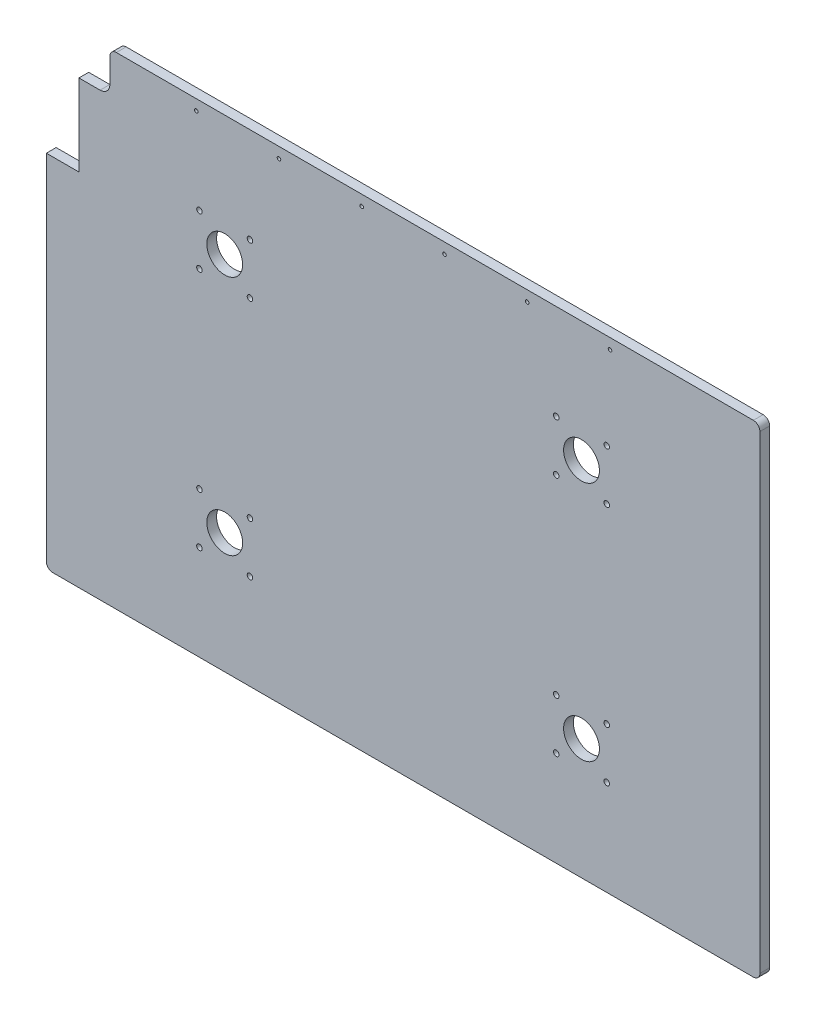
SolidWorks part; units mm, degrees
ref_plane "Front" through (0, 0, 0) normal (0, 0, 1) x (1, 0, 0)
ref_plane "Top" through (0, 0, 0) normal (0, 1, 0) x (1, 0, 0)
ref_plane "Right" through (0, 0, 0) normal (1, 0, 0) x (0, 0, -1)
ref_plane "deck plane" through (0, 0, 66) normal (0, 0, 1) x (1, 0, 0)
sketch "Sketch2" plane through (0, 0, 66) normal (0, 0, 1) x (1, 0, 0)
  line L0 (-221, 155.5) -> (-221, -155.5) construction
  line L1 (-219, 143.5) -> (219, 143.5)
  line L2 (-219, 143.5) -> (-219, -152.5)
  line L3 (-219, -152.5) -> (219, -152.5)
  line L4 (219, 143.5) -> (219, -152.5)
  line L5 (221, -155.5) -> (221, 155.5) construction
  line L6 (-221, -155.5) -> (221, -155.5) construction
  line L7 (221, 155.5) -> (-221, 155.5) construction
  dimension "D1" = 2
  dimension "D2" = 2
  dimension "D3" = 3
  dimension "D4" = 12
extrude "Boss-Extrude1" add sketch "Sketch2" along normal blind 6
sketch "motor locations" plane through (0, 0, 72) normal (0, 0, 1) x (1, 0, 0)
  line L0 (219, -4.5) -> (-219, -4.5) construction
  line L1 (219, -152.5) -> (219, 143.5) construction
  line L2 (-219, 143.5) -> (-219, -152.5) construction
  line L3 (0, 143.5) -> (0, -152.5) construction
  line L4 (219, 143.5) -> (-219, 143.5) construction
  line L5 (-219, -152.5) -> (219, -152.5) construction
  line L6 (-219, -152.5) -> (0, -4.5) construction
  line L7 (-219, 143.5) -> (0, -4.5) construction
  line L8 (0, -4.5) -> (219, 143.5) construction
  line L9 (219, -152.5) -> (0, -4.5) construction
  point P20 (-109.5, -78.5)
  point P22 (109.5, -78.5)
  point P23 (109.5, 69.5)
  point P24 (-109.5, 69.5)
  point P26 (0, 0)
  point P27 (0, 0)
  point P28 (0, 0)
  point P29 (0, 0)
  dimension "D1" = 109.5
  dimension "D2" = 74
  dimension "D3" = 74
  dimension "D4" = 4.5
  dimension "D5" = 296
  dimension "D6" = 438
sketch "Sketch3" plane through (0, 0, 72) normal (0, 0, 1) x (1, 0, 0)
  line L1 (-219, -152.5) -> (219, -152.5) construction
  line B0 (-130.65, -99.65) -> (-88.35, -99.65) construction
  circle B1 centre (-109.5, -78.5) radius 11
  circle B2 centre (-125, -94) radius 1.7
  circle B3 centre (-94, -94) radius 1.7
  circle B4 centre (-125, -63) radius 1.7
  circle B5 centre (-94, -63) radius 1.7
sketch_block_instance "Block-NEMA17-mounting-1"
sketch_block "Block-NEMA17-mounting" parameters "D1"=22, "D2"=3.4, "D3"=31, "D4"=42.3
extrude "first motor mount" cut sketch "Sketch3" against normal through all
pattern_sketch "motor pattern" of "first motor mount"
sketch "Sketch4" plane through (0, 0, 66) normal (0, 0, -1) x (-1, 0, 0)
  circle A0 centre (127, 136.9747) radius 1.1
  circle A1 centre (76.2, 136.9747) radius 1.1
  circle A2 centre (25.4, 136.9747) radius 1.1
  circle A3 centre (-25.4, 136.9747) radius 1.1
  circle A4 centre (-76.2, 136.9747) radius 1.1
  circle A5 centre (-127, 136.9747) radius 1.1
  circle A6 centre (-127, 136.9747) radius 2.3564 construction
  circle A7 centre (-76.2, 136.9747) radius 2.3564 construction
  circle A8 centre (-25.4, 136.9747) radius 2.3564 construction
  circle A9 centre (25.4, 136.9747) radius 2.3564 construction
  circle A10 centre (76.2, 136.9747) radius 2.3564 construction
  circle A11 centre (127, 136.9747) radius 2.3564 construction
  circle A12 centre (-127, 136.9747) radius 2.3564 construction
  circle A13 centre (-76.2, 136.9747) radius 2.3564 construction
  circle A14 centre (-25.4, 136.9747) radius 2.3564 construction
  circle A15 centre (25.4, 136.9747) radius 2.3564 construction
  circle A16 centre (76.2, 136.9747) radius 2.3564 construction
  circle A17 centre (127, 136.9747) radius 2.3564 construction
  dimension "D1" = 2.2
extrude "hinge screw pilot holes" cut sketch "Sketch4" against normal through all
sketch "Sketch5" plane through (0, 0, 72) normal (0, 0, 1) x (1, 0, 0)
  line L0 (-180, 143.5) -> (-205, 143.5)
  line L1 (219, 143.5) -> (-219, 143.5) construction
  line L2 (-205, 143.5) -> (-205, 124.5)
  line L3 (-199, 118.5) -> (-186, 118.5)
  line L4 (-180, 124.5) -> (-180, 143.5)
  line L6 (-219, 143.5) -> (-219, -152.5) construction
  arc A0 (-205, 124.5) -> (-199, 118.5) centre (-199, 124.5) ccw
  arc A1 (-186, 118.5) -> (-180, 124.5) centre (-186, 124.5) ccw
  dimension "D1" = 6
  dimension "D2" = 25
  dimension "D3" = 25
  dimension "D4" = 14
extrude "cable and wire notch" cut sketch "Sketch5" against normal up to next
fillet "Fillet1" radius 4 6 edges at (219, 143.5, 69) (219, -152.5, 69) (-219, -152.5, 69) (-219, 143.5, 69) (-180, 143.5, 69) (-205, 143.5, 69)
sketch "Sketch6" plane through (0, 0, 72) normal (0, 0, 1) x (1, 0, 0)
  line L0 (-219, 139.5) -> (-219, -148.5) construction
  line L1 (-219, 68.5) -> (-199, 68.5)
  line L2 (-219, 68.5) -> (-219, 143.5)
  line L3 (-219, 143.5) -> (-199, 143.5)
  line L4 (-199, 68.5) -> (-199, 143.5)
  line L5 (215, 143.5) -> (-176, 143.5) construction
  point P9 (-202.3194, 152.6427)
  dimension "D1" = 75
extrude "hinge clearance cut" cut sketch "Sketch6" against normal up to next
